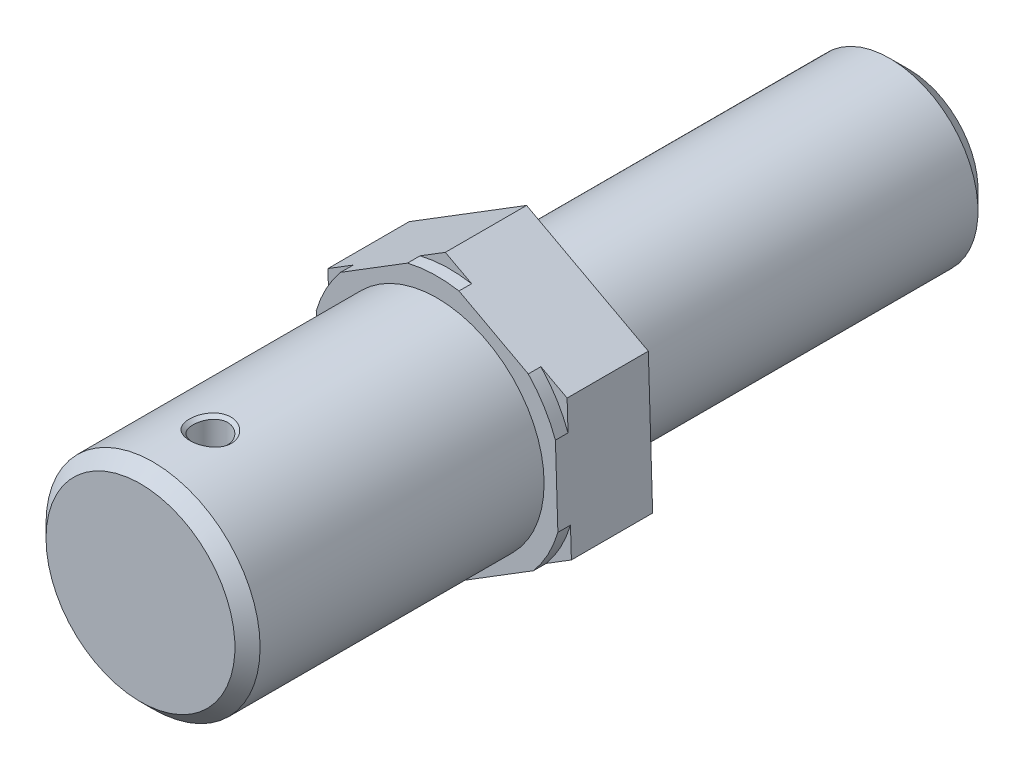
SolidWorks part; units mm, degrees
ref_plane "Face" through (0, 0, 0) normal (0, 0, 1) x (1, 0, 0)
ref_plane "Dessus" through (0, 0, 0) normal (0, 1, 0) x (1, 0, 0)
ref_plane "Droite" through (0, 0, 0) normal (1, 0, 0) x (0, 0, -1)
sketch "Esquisse1" plane through (0, 0, 0) normal (0, 0, 1) x (1, 0, 0)
  line L1 (9.666, -5.1866) -> (9.3248, 5.7777)
  line L2 (9.3248, 5.7777) -> (-0.3412, 10.9643)
  line L3 (-0.3412, 10.9643) -> (-9.666, 5.1866)
  line L4 (-9.666, 5.1866) -> (-9.3248, -5.7777)
  line L5 (-9.3248, -5.7777) -> (0.3412, -10.9643)
  line L6 (0.3412, -10.9643) -> (9.666, -5.1866)
  circle A0 centre (0, 0) radius 9.5 construction
  dimension "D1" = 19
extrude "Extrusion1" add sketch "Esquisse1" along normal blind 31
sketch "Esquisse2" plane through (0, 0, 0) normal (1, 0, 0) x (0, 0, -1)
  line L0 (1.4932, 0) -> (-36.0009, 0) construction
  line L1 (-6.45, 13.086) -> (-6.45, 10)
  line L2 (-6.45, 10) -> (-7.45, 10)
  line L3 (-7.45, 10) -> (-7.45, 8.5)
  line L4 (-7.45, 8.5) -> (-35.8368, 8.5)
  line L5 (-35.8368, 8.5) -> (-35.8368, 13.086)
  line L6 (-35.8368, 13.086) -> (-6.45, 13.086)
  dimension "D1" = 7.45
  dimension "D2" = 10
  dimension "D3" = 8.5
  dimension "D4" = 3.086
  dimension "D5" = 1
revolve "Enlèvement de matière-Révolution1" cut sketch "Esquisse2" angle 360 about L0
chamfer "Chanfrein1" distance 1 angle 45 1 edges at (-8.5, 0, 31)
sketch "Esquisse4" plane through (0, 0, 0) normal (0, 0, -1) x (-1, 0, 0)
  circle A0 centre (0, 0) radius 7
  dimension "D1" = 14
extrude "Extrusion2" add sketch "Esquisse4" along normal blind 30
chamfer "Chanfrein3" distance 1.5 angle 45 1 edges at (-7, 0, -30)
sketch "Esquisse5" plane through (0, 0, 0) normal (0, 1, 0) x (1, 0, 0)
  line L0 (-7.6579, -7.45) -> (-2.3493, -7.45) construction
  circle A0 centre (0, -25.45) radius 1.375
  dimension "D2" = 2.75
  dimension "D1" = 18
extrude "Enlèv. mat.-Extru.1" cut sketch "Esquisse5" against normal through all and the other way through all
chamfer "Chanfrein4" distance 0.25 angle 45 2 edges at (-0.2961, -8.4948, 24.1073) (0.2961, 8.4948, 24.1073)
